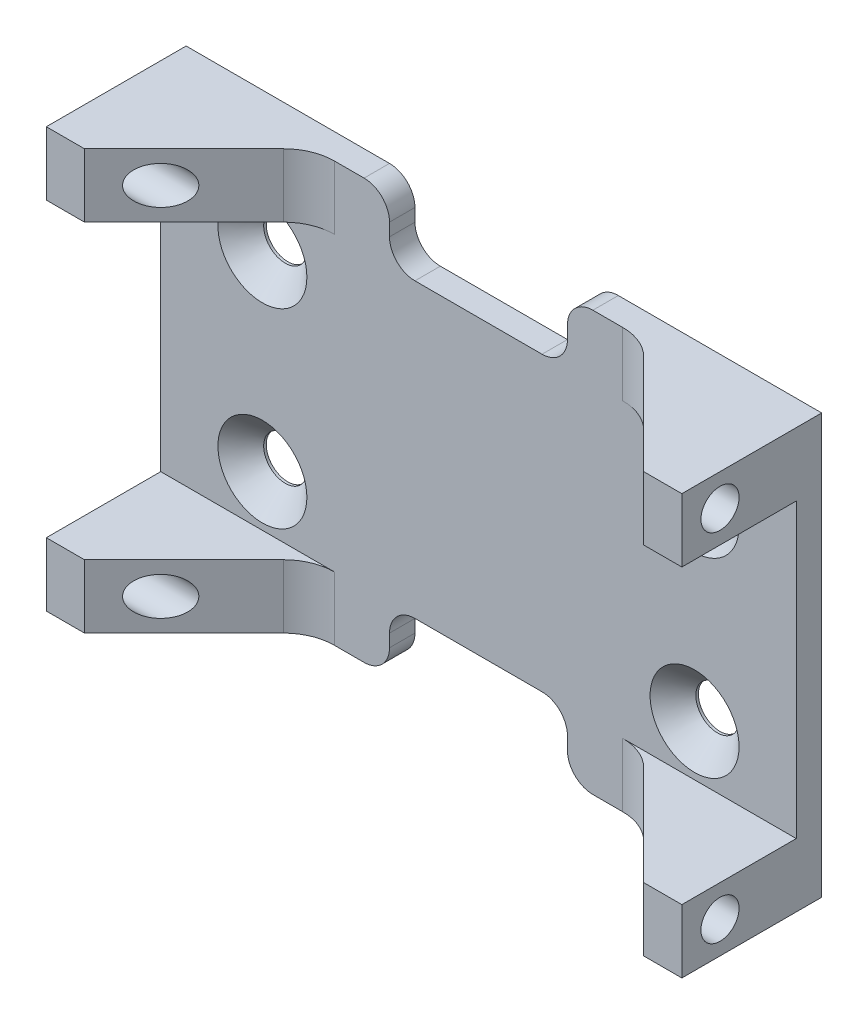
SolidWorks part; units mm, degrees
ref_plane "Piano frontale" through (0, 0, 0) normal (0, 0, 1) x (1, 0, 0)
ref_plane "Piano superiore" through (0, 0, 0) normal (0, 1, 0) x (1, 0, 0)
ref_plane "Piano destro" through (0, 0, 0) normal (1, 0, 0) x (0, 0, -1)
sketch "Schizzo1" plane through (0, 0, 0) normal (0, 0, 1) x (1, 0, 0)
  line L1 (-25, 16.5) -> (25, 16.5)
  line L2 (-25, 16.5) -> (-25, -16.5)
  line L3 (-25, -16.5) -> (25, -16.5)
  line L4 (25, 16.5) -> (25, -16.5)
  line L5 (-25, 16.5) -> (25, -16.5) construction
  line L6 (-25, -16.5) -> (25, 16.5) construction
  point P0 (0, 0)
  dimension "D1" = 50
  dimension "D2" = 33
extrude "Estrusione-Estrusione1" add sketch "Schizzo1" along normal blind 2
sketch "Schizzo2" plane through (0, 0, 2) normal (0, 0, 1) x (1, 0, 0)
  line L0 (0, 16.5) -> (0, 0) construction
  line L1 (-25, 16.5) -> (-22, 16.5)
  line L2 (-25, 16.5) -> (-25, 11.5)
  line L3 (-25, 11.5) -> (-22, 11.5)
  line L4 (-22, 16.5) -> (-22, 11.5)
  line L5 (25, 16.5) -> (-25, 16.5) construction
  line L6 (0, 0) -> (-25, 0) construction
  line L7 (-25, 16.5) -> (-25, -16.5) construction
  line L8 (-22, -16.5) -> (-22, -11.5)
  line L9 (-25, -11.5) -> (-22, -11.5)
  line L10 (-25, -16.5) -> (-25, -11.5)
  line L11 (-25, -16.5) -> (-22, -16.5)
  line L12 (25, -16.5) -> (22, -16.5)
  line L13 (25, -16.5) -> (25, -11.5)
  line L14 (25, -11.5) -> (22, -11.5)
  line L15 (22, -16.5) -> (22, -11.5)
  line L16 (22, 16.5) -> (22, 11.5)
  line L17 (25, 11.5) -> (22, 11.5)
  line L18 (25, 16.5) -> (25, 11.5)
  line L19 (25, 16.5) -> (22, 16.5)
  dimension "D1" = 3
  dimension "D2" = 11.5
extrude "Estrusione-Estrusione2" add sketch "Schizzo2" along normal blind 9
chamfer "Smusso1" distance 9 angle 45 4 edges at (22, -14, 2) (22, 14, 2) (-22, -14, 2) (-22, 14, 2)
sketch "Schizzo3" plane through (-25, 0, 0) normal (-1, 0, 0) x (0, 0, 1)
  line L1 (2, 11.5) -> (2, -11.5) construction
  line L2 (0, 0) -> (15.1231, 0) construction
  circle A0 centre (8, 14) radius 1.5
  circle A1 centre (8, -14) radius 1.5
  dimension "D1" = 3
  dimension "D2" = 14
  dimension "D3" = 6
extrude "Taglio-Estrusione1" cut sketch "Schizzo3" against normal through all
fillet "Raccordo1" radius 4 4 edges at (-13, -14, 2) (13, -14, 2) (13, 14, 2) (-13, 14, 2)
sketch "Schizzo4" plane through (0, 0, 2) normal (0, 0, 1) x (1, 0, 0)
  line L0 (-17, 7.5) -> (-17, -7.5) construction
  line L1 (-25, 11.5) -> (-25, -11.5) construction
  circle A0 centre (-17, 7.5) radius 1.7
  circle A1 centre (-17, -7.5) radius 1.7
  point P6 (-17, 0)
  dimension "D3" = 3.4
  dimension "D1" = 15
  dimension "D2" = 8
extrude "Taglio-Estrusione2" cut sketch "Schizzo4" against normal through all
chamfer "Smusso2" distance 1.8 angle 45 2 edges at (-15.3, -7.5, 2) (-15.3, 7.5, 2)
mirror "Specchia1" about plane through (0, 0, 0) normal (1, 0, 0) of "Taglio-Estrusione2", "Smusso2"
sketch "Schizzo5" plane through (0, 0, 2) normal (0, 0, 1) x (1, 0, 0)
  line L0 (11.3431, 16.5) -> (-11.3431, 16.5) construction
  line L1 (-7, 16.5) -> (7, 16.5)
  line L2 (-7, 16.5) -> (-7, 11.5)
  line L3 (-7, 11.5) -> (7, 11.5)
  line L4 (7, 16.5) -> (7, 11.5)
  point P6 (0, 11.5)
  dimension "D1" = 5
  dimension "D2" = 14
extrude "Taglio-Estrusione3" cut sketch "Schizzo5" against normal blind 10
mirror "Specchia2" about plane through (0, 0, 0) normal (0, 1, 0) of "Taglio-Estrusione3"
fillet "Raccordo2" radius 2 8 edges at (-7, 11.5, 1) (-7, 16.5, 1) (7, 16.5, 1) (7, 11.5, 1) (-7, -16.5, 1) (-7, -11.5, 1) (7, -11.5, 1) (7, -16.5, 1)
